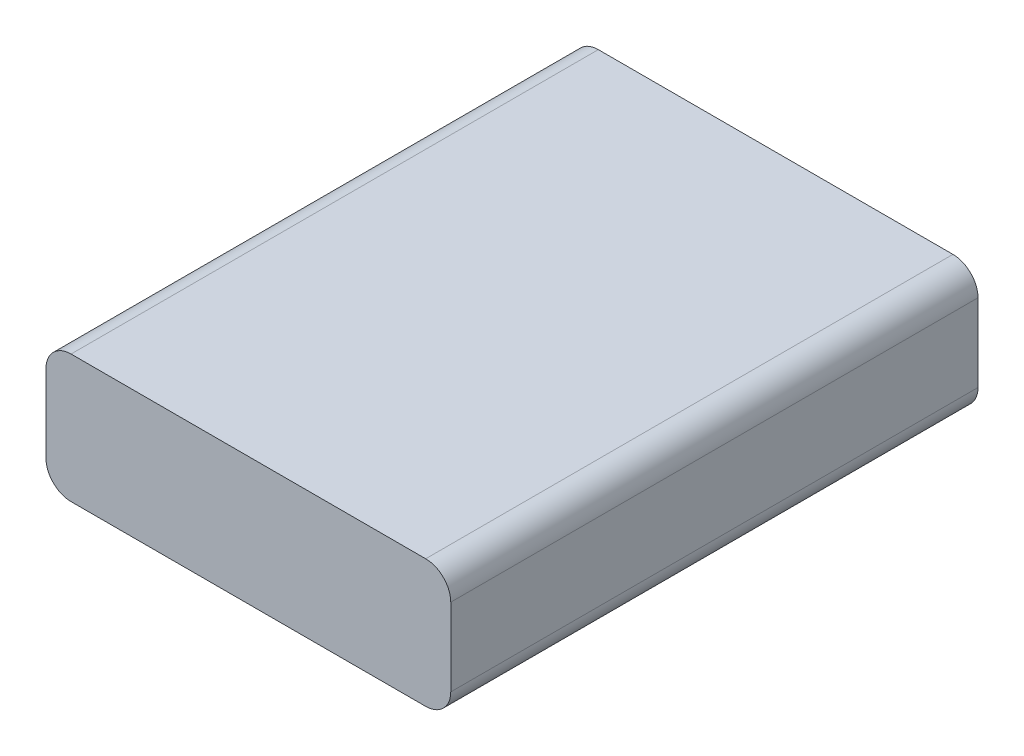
SolidWorks part; units mm, degrees
ref_plane "Plan de face" through (0, 0, 0) normal (0, 0, 1) x (1, 0, 0)
ref_plane "Plan de dessus" through (0, 0, 0) normal (0, 1, 0) x (1, 0, 0)
ref_plane "Plan de droite" through (0, 0, 0) normal (1, 0, 0) x (0, 0, -1)
sketch "Esquisse1" plane through (0, 0, 0) normal (0, 1, 0) x (1, 0, 0)
  line L1 (-24.22, 31.55) -> (24.22, 31.55)
  line L2 (-24.22, 31.55) -> (-24.22, -31.55)
  line L3 (-24.22, -31.55) -> (24.22, -31.55)
  line L4 (24.22, 31.55) -> (24.22, -31.55)
  line L5 (-24.22, 31.55) -> (24.22, -31.55) construction
  line L6 (-24.22, -31.55) -> (24.22, 31.55) construction
  point P0 (0, 0)
extrude "Boss.-Extru.1" add sketch "Esquisse1" along normal blind 15.3
sketch "Esquisse2" plane through (0, 0, 0) normal (0, -1, 0) x (1, 0, 0)
  line L0 (37.7056, 31.55) -> (-26.955, 31.55) construction
  line L1 (37.7056, 27.25) -> (-26.955, 27.25) construction
  line L2 (37.7056, 24.15) -> (0, 24.15) construction
  line L3 (15.22, 35.273) -> (15.22, 17.8523) construction
  line L4 (9.22, 35.273) -> (9.22, 17.8523) construction
  line L5 (24.22, 36.4501) -> (24.22, 17.8523) construction
  line L8 (9.22, 27.25) -> (15.22, 27.25)
  line L9 (9.22, 27.25) -> (9.22, 24.15)
  line L10 (9.22, 24.15) -> (15.22, 24.15)
  line L11 (15.22, 27.25) -> (15.22, 24.15)
  dimension "D1" = 3.1
  dimension "D2" = 4.3
  dimension "D3" = 9
  dimension "D4" = 6
extrude "Boss.-Extru.2" add sketch "Esquisse2" along normal blind 1.9
fillet "Congé1" radius 3 4 edges at (-24.22, 0, 0) (-24.22, 15.3, 0) (24.22, 15.3, 0) (24.22, 0, 0)
